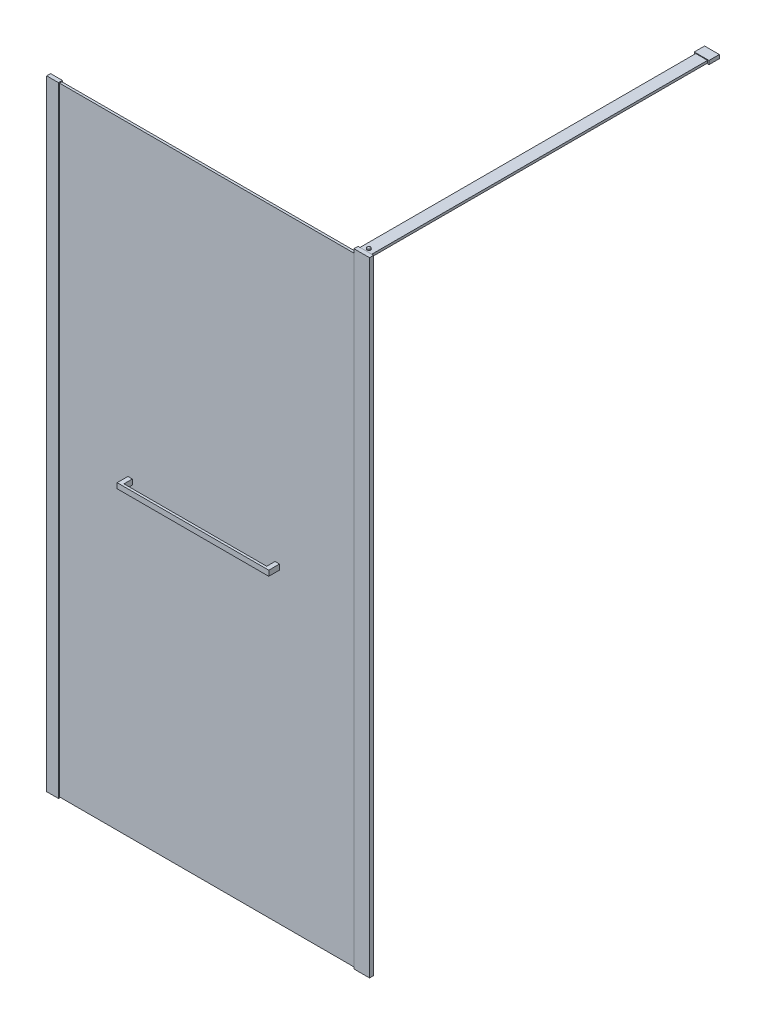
SolidWorks part; units mm, degrees
ref_plane "Płaszczyzna przednia" through (0, 0, 0) normal (0, 0, 1) x (1, 0, 0)
ref_plane "Płaszczyzna górna" through (0, 0, 0) normal (0, 1, 0) x (1, 0, 0)
ref_plane "Płaszczyzna prawa" through (0, 0, 0) normal (1, 0, 0) x (0, 0, -1)
sketch "Szkic1" plane through (0, 0, 0) normal (0, 1, 0) x (1, 0, 0)
  line L0 (0, 0) -> (0, 13.3)
  line L1 (0, 13.3) -> (40, 13.3)
  line L2 (40, 13.3) -> (40, 11.4)
  line L3 (40, 11.4) -> (6.5, 11.4)
  line L4 (6.5, 11.4) -> (6.5, 3.4)
  line L5 (6.5, 3.4) -> (40, 3.4)
  line L6 (40, 3.4) -> (40, 0)
  line L7 (40, 0) -> (0, 0)
  dimension "D1" = 40
  dimension "D2" = 13.3
  dimension "D3" = 33.5
  dimension "D4" = 1.9
  dimension "D5" = 8
extrude "Dodanie-wyciągnięcie1" add sketch "Szkic1" along normal blind 2100 from offset 3
sketch "Szkic2" plane through (0, 3, 0) normal (0, -1, 0) x (1, 0, 0)
  line L0 (6.5, -11.4) -> (40, -11.4) construction
  line L1 (6.5, -3.4) -> (1053.5, -3.4)
  line L2 (6.5, -3.4) -> (6.5, -11.4)
  line L3 (6.5, -11.4) -> (1053.5, -11.4)
  line L4 (1053.5, -3.4) -> (1053.5, -11.4)
  dimension "D1" = 1047
extrude "Dodanie-wyciągnięcie2" add sketch "Szkic2" against normal blind 2100 separate body
sketch "Szkic3" plane through (0, 3, 0) normal (0, -1, 0) x (1, 0, 0)
  line L0 (1043.4, -3.4) -> (1043.4, -0.4)
  line L1 (1053.5, -3.4) -> (6.5, -3.4) construction
  line L2 (1043.4, -0.4) -> (1096.4, -0.4)
  line L3 (1096.4, -0.4) -> (1096.4, -14.4)
  line L4 (1096.4, -14.4) -> (1043.4, -14.4)
  line L5 (1043.4, -14.4) -> (1043.4, -11.4)
  line L6 (1043.4, -11.4) -> (1053.5, -11.4)
  line L7 (1053.5, -11.4) -> (1053.5, -3.4)
  line L8 (1053.5, -3.4) -> (1043.4, -3.4)
  line L9 (6.5, -11.4) -> (1053.5, -11.4) construction
  line L10 (1053.5, -11.4) -> (1053.5, -3.4) construction
  dimension "D1" = 10.1
  dimension "D2" = 3
  dimension "D3" = 3
  dimension "D4" = 53
extrude "Dodanie-wyciągnięcie3" add sketch "Szkic3" against normal blind 2108 separate body
sketch "Szkic4" plane through (0, 2103, 0) normal (0, 1, 0) x (1, 0, 0)
  line L1 (0, 13.3) -> (40, 13.3)
  line L2 (0, 13.3) -> (0, 0)
  line L3 (0, 0) -> (40, 0)
  line L4 (40, 13.3) -> (40, 0)
extrude "Dodanie-wyciągnięcie4" add sketch "Szkic4" along normal blind 3
sketch "Szkic5" plane through (0, 2111, 0) normal (0, 1, 0) x (1, 0, 0)
  line L1 (1096.4, 14.4) -> (1043.4, 14.4)
  line L2 (1096.4, 14.4) -> (1096.4, 0.4)
  line L3 (1096.4, 0.4) -> (1043.4, 0.4)
  line L4 (1043.4, 14.4) -> (1043.4, 0.4)
extrude "Dodanie-wyciągnięcie5" add sketch "Szkic5" along normal blind 8
sketch "Szkic6" plane through (1043.4, 0, 0) normal (-1, 0, 0) x (0, 0, 1)
  line L0 (-11.4, 2111) -> (-3.4, 2111) construction
  line L1 (-3.35, 2111) -> (-11.45, 2111)
  line L2 (-3.35, 2111) -> (-3.35, 2103.2)
  line L3 (-3.35, 2103.2) -> (-11.45, 2103.2)
  line L4 (-11.45, 2111) -> (-11.45, 2103.2)
  point P6 (-7.4, 2111)
  dimension "D1" = 8.1
  dimension "D2" = 7.8
extrude "Dodanie-wyciągnięcie6" add sketch "Szkic6" against normal blind 15 from offset 1.3
sketch "Szkic7" plane through (0, 3, 0) normal (0, -1, 0) x (1, 0, 0)
  line L1 (1043.4, -0.4) -> (1096.4, -0.4)
  line L2 (1043.4, -0.4) -> (1043.4, -14.4)
  line L3 (1043.4, -14.4) -> (1096.4, -14.4)
  line L4 (1096.4, -0.4) -> (1096.4, -14.4)
extrude "Dodanie-wyciągnięcie7" add sketch "Szkic7" along normal blind 3
sketch "Szkic8" plane through (0, 3, 0) normal (0, -1, 0) x (1, 0, 0)
  line L1 (0, 0) -> (40, 0)
  line L2 (0, 0) -> (0, -13.3)
  line L3 (0, -13.3) -> (40, -13.3)
  line L4 (40, 0) -> (40, -13.3)
extrude "Dodanie-wyciągnięcie8" add sketch "Szkic8" along normal blind 3
sketch "Szkic9" plane through (0, 0, -14.4) normal (0, 0, -1) x (-1, 0, 0)
  line L0 (-1096.4, 2119) -> (-1043.4, 2119) construction
  line L1 (-1089.9, 2119) -> (-1049.9, 2119)
  line L2 (-1089.9, 2119) -> (-1089.9, 2111)
  line L3 (-1089.9, 2111) -> (-1049.9, 2111)
  line L4 (-1049.9, 2119) -> (-1049.9, 2111)
  line L5 (-1096.4, 2119) -> (-1096.4, 0) construction
  line L6 (-1043.4, 2119) -> (-1043.4, 0) construction
  dimension "D1" = 6.5
  dimension "D2" = 6.5
  dimension "D3" = 8
extrude "Dodanie-wyciągnięcie9" add sketch "Szkic9" along normal blind 1170 separate body
sketch "Szkic10" plane through (0, 0, -1184.4) normal (0, 0, -1) x (-1, 0, 0)
  line L0 (-1069.9, 2119) -> (-1069.9, 2115) construction
  line L1 (-1094.9, 2121.25) -> (-1044.9, 2121.25)
  line L2 (-1094.9, 2121.25) -> (-1094.9, 2108.75)
  line L3 (-1094.9, 2108.75) -> (-1044.9, 2108.75)
  line L4 (-1044.9, 2121.25) -> (-1044.9, 2108.75)
  line L5 (-1094.9, 2121.25) -> (-1044.9, 2108.75) construction
  line L6 (-1094.9, 2108.75) -> (-1044.9, 2121.25) construction
  line L7 (-1049.9, 2119) -> (-1089.9, 2119) construction
  line L8 (-1069.9, 2115) -> (-1089.9, 2115) construction
  line L9 (-1089.9, 2119) -> (-1089.9, 2111) construction
  point P0 (-1069.9, 2115)
  dimension "D1" = 12.5
  dimension "D2" = 50
extrude "Dodanie-wyciągnięcie10" add sketch "Szkic10" along normal blind 35 from offset 29.4
ref_plane "Płaszczyzna1" through (1069.9, 0, 0) normal (1, 0, 0) x (0, 0, -1)
sketch "Szkic11" plane through (1069.9, 0, 0) normal (1, 0, 0) x (0, 0, -1)
  line L0 (24.4, 2119) -> (24.4, 2127.4416) construction
  line L1 (24.4, 2119) -> (34.6926, 2119) construction
  line L2 (30.3, 2119) -> (30.05, 2122.8)
  line L3 (24.4, 2124.7) -> (30.2413, 2124.7) construction
  line L4 (24.4, 2124.7) -> (24.4, 2124.2)
  line L5 (1155, 2119) -> (14.4, 2119) construction
  line L6 (14.4, 2119) -> (14.4, 2111) construction
  line L7 (29.7989, 2119) -> (30.3, 2119)
  line L9 (29.5663, 2122.5357) -> (29.7989, 2119)
  arc A0 (24.4, 2124.7) -> (30.05, 2122.8) centre (24.4, 2115.3493) cw
  arc A1 (29.5663, 2122.5357) -> (24.4, 2124.2) centre (24.4, 2115.3493) ccw
  dimension "D1" = 0.5
  dimension "D2" = 11.3
  dimension "D3" = 5.7
  dimension "D4" = 3.8
  dimension "D5" = 11.8
  dimension "D6" = 0.5
  dimension "D7" = 10
revolve "Obrót1" add sketch "Szkic11" angle 360 about L0
sketch "Szkic12" plane through (0, 0, -3.4) normal (0, 0, 1) x (1, 0, 0)
  line L0 (530, 1409.7928) -> (530, 762.3594) construction
  line L1 (280, 1053) -> (780, 1053) construction
  line L2 (6.5, 2103) -> (6.5, 3) construction
  line L3 (1053.5, 2103) -> (1053.5, 3) construction
  line L5 (272.5, 1062) -> (287.5, 1062)
  line L6 (272.5, 1062) -> (272.5, 1044)
  line L7 (272.5, 1044) -> (287.5, 1044)
  line L8 (287.5, 1062) -> (287.5, 1044)
  line L9 (272.5, 1062) -> (287.5, 1044) construction
  line L10 (272.5, 1044) -> (287.5, 1062) construction
  line L11 (772.5, 1062) -> (787.5, 1062)
  line L12 (772.5, 1062) -> (772.5, 1044)
  line L13 (772.5, 1044) -> (787.5, 1044)
  line L14 (787.5, 1062) -> (787.5, 1044)
  line L15 (772.5, 1062) -> (787.5, 1044) construction
  line L16 (772.5, 1044) -> (787.5, 1062) construction
  dimension "D1" = 1053
  dimension "D2" = 500
  dimension "D3" = 15
  dimension "D4" = 18
extrude "Dodanie-wyciągnięcie11" add sketch "Szkic12" along normal blind 36.5 and the other way blind 18 separate body
sketch "Szkic13" plane through (287.5, 0, 0) normal (1, 0, 0) x (0, 0, -1)
  line L0 (21.4, 1044) -> (-33.1, 1044) construction
  line L1 (-33.1, 1062) -> (-25.1, 1062)
  line L2 (-33.1, 1062) -> (-33.1, 1044)
  line L3 (-33.1, 1044) -> (-25.1, 1044)
  line L4 (-25.1, 1062) -> (-25.1, 1044)
  dimension "D1" = 8
extrude "Dodanie-wyciągnięcie12" add sketch "Szkic13" along normal up to surface (485 mm away)
